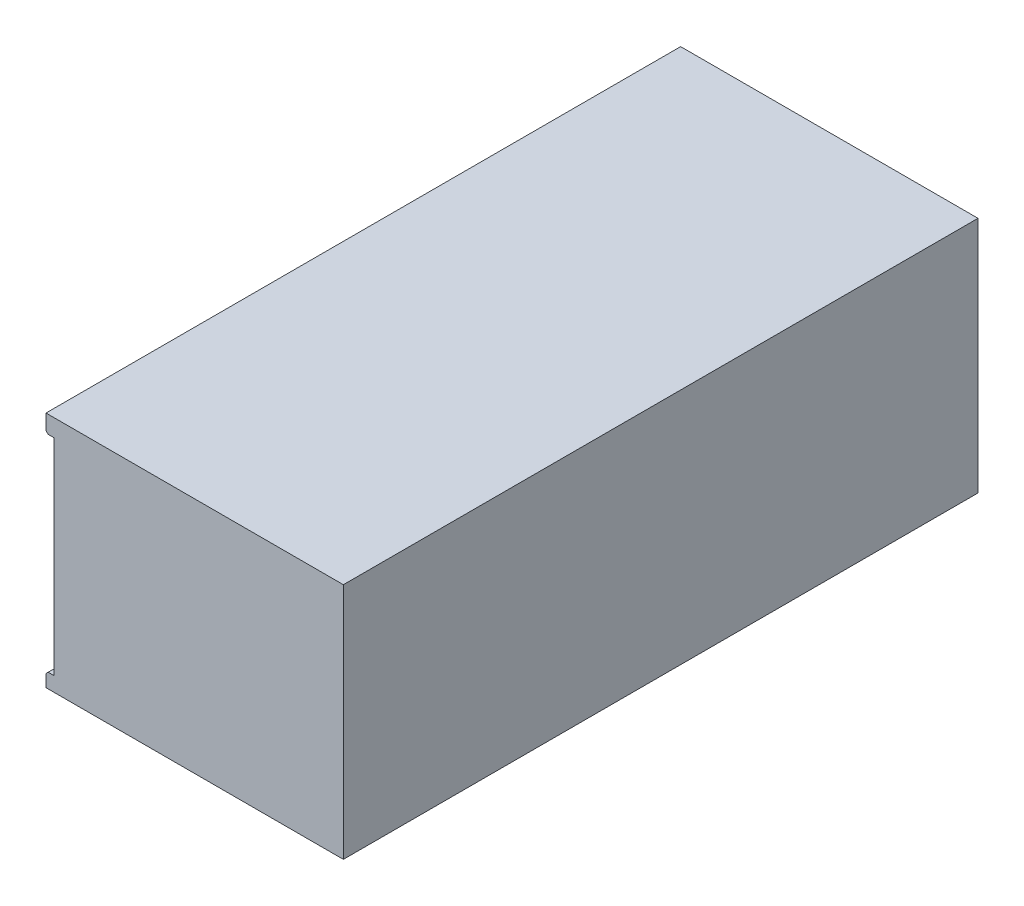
SolidWorks part; units mm, degrees
ref_plane "FRONT" through (0, 0, 0) normal (0, 0, 1) x (1, 0, 0)
ref_plane "TOP" through (0, 0, 0) normal (0, 1, 0) x (1, 0, 0)
ref_plane "RIGHT" through (0, 0, 0) normal (1, 0, 0) x (0, 0, -1)
sketch "Sketch1" plane through (0, 0, 0) normal (0, 0, 1) x (1, 0, 0)
  line L0 (50.673, 0) -> (50.673, -41.656)
  line L1 (50.673, -41.656) -> (-1.397, -41.656)
  line L2 (-1.397, -41.656) -> (-1.397, -39.116)
  line L3 (-1.397, -39.116) -> (0, -39.116)
  line L4 (0, -39.116) -> (0, -3.048)
  line L5 (0, -3.048) -> (-1.397, -3.048)
  line L6 (-1.397, -3.048) -> (-1.397, 0)
  line L7 (-1.397, 0) -> (50.673, 0)
  dimension "D1" = 52.07
  dimension "D2" = 50.673
  dimension "D3" = 3.048
  dimension "D4" = 2.54
  dimension "D5" = 41.656
extrude "Extrude1" add sketch "Sketch1" along normal mid plane 111.125
sketch "Sketch2" plane through (0, 0, 0) normal (-1, 0, 0) x (0, 0, 1)
  line L0 (0, 0) -> (0, -41.656) construction
  line L1 (55.5625, -41.656) -> (-55.5625, -41.656) construction
  line L2 (0, -20.828) -> (49.1702, -20.828) construction
  point P0 (-50.2666, -6.35)
  point P1 (50.2666, -6.35)
  point P2 (4.8768, -6.35)
  point P4 (-4.8768, -6.35)
  point P5 (-50.2666, -35.814)
  point P7 (-4.8768, -35.814)
  point P8 (4.8768, -35.814)
  point P14 (50.2666, -35.814)
  dimension "D1" = 50.2666
  dimension "D2" = 50.2666
  dimension "D3" = 4.8768
  dimension "D4" = 14.478
  dimension "D5" = 14.986
hole_wizard "#10-32 Tapped Hole1" positions "3DSketch1" profile "Sketch3" tap size "#10-32" standard "Ansi Inch"
sketch3d "3DSketch1"
  point P0 (0, -6.35, -50.2666)
  point P3 (0, -6.35, 50.2666)
  point P6 (0, -6.35, 4.8768)
  point P9 (0, -6.35, -4.8768)
  point P12 (0, -35.814, -50.2666)
  point P15 (0, -35.814, -4.8768)
  point P18 (0, -35.814, 4.8768)
  point P21 (0, -35.814, 50.2666)
sketch "Sketch3" plane through (0, -6.35, -50.2666) normal (0, 1, 0) x (0, 0, 1)
  line L0 (0, 0) -> (0, 11.2108)
  line L1 (0, 11.2108) -> (2.0193, 9.9974)
  line L2 (2.0193, 9.9974) -> (2.0193, 7.62)
  line L3 (2.0193, 7.62) -> (2.413, 7.62)
  line L4 (2.413, 7.62) -> (2.413, 0)
  line L5 (2.413, 0) -> (0, 0)
  line L10 (0, 11.2108) -> (-2.0193, 9.9974) construction
  line L11 (0, -6.35) -> (0, 107.95) construction
  dimension "Tap Drill Dia." = 4.0386
  dimension "Tap Drill Depth" = 9.9974
  dimension "Thread Major Dia." = 4.826
  dimension "Thread Depth" = 7.62
  dimension "Drill Angle" = 118
chamfer "Chamfer1" distance 0.381 angle 45 2 edges at (-1.397, -39.116, 0) (-1.397, -3.048, 0)
